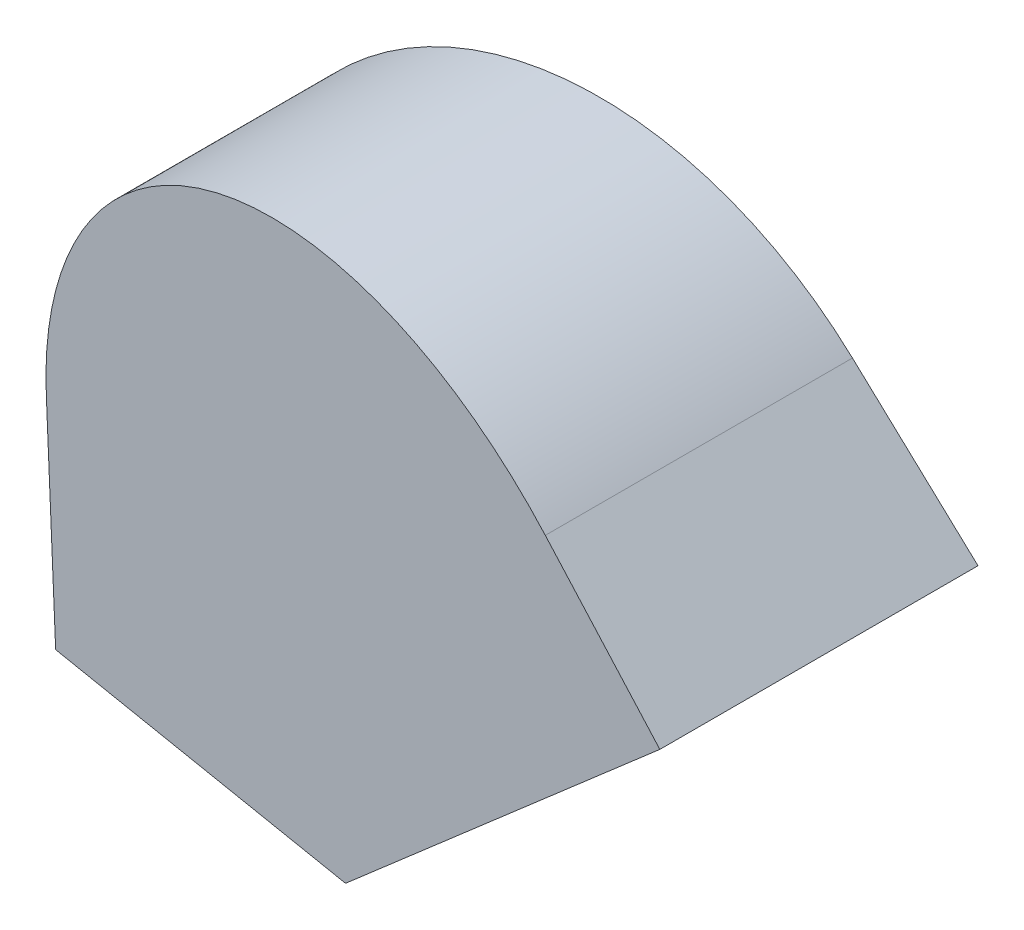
SolidWorks part; units mm, degrees
ref_plane "Front Plane" through (0, 0, 0) normal (0, 0, 1) x (1, 0, 0)
ref_plane "Top Plane" through (0, 0, 0) normal (0, 1, 0) x (1, 0, 0)
ref_plane "Right Plane" through (0, 0, 0) normal (1, 0, 0) x (0, 0, -1)
sketch "Sketch1" plane through (0, 0, 0) normal (0, 0, 1) x (1, 0, 0)
  line L0 (-36.5, 0) -> (0, 0)
  line L1 (0, 0) -> (43.474, 39.1441)
  line L2 (43.474, 39.1441) -> (30.2772, 51.4504)
  line L3 (-36.5, 0) -> (-35.1898, 25)
  line L4 (-36.5, 0) -> (-36.5, 25) construction
  line L5 (43.474, 39.1441) -> (22.2035, 62.7674) construction
  arc A0 (-35.1898, 25) -> (30.2772, 51.4504) centre (3.7107, 22.9613) cw
  dimension "D1" = 36.5
  dimension "D2" = 58.5
  dimension "D3" = 42
  dimension "D4" = 3
  dimension "D5" = 5
  dimension "D6" = 25
sketch "Sketch2" plane through (0, 0, 0) normal (0, 1, 0) x (1, 0, 0)
  line L1 (-36.5, 0) -> (0, 0)
  line L2 (0, 0) -> (0, -23)
  line L3 (0, -23) -> (-19.7629, -19.732)
  arc A0 (-19.7629, -19.732) -> (-36.5, 0) centre (-16.5, 0) cw
  dimension "D1" = 20
  dimension "D2" = 23
ref_plane "42 deg" through (0, 0, 0) normal (-0.6691, 0.7431, 0) x (-0.7431, -0.6691, 0)
sketch "Sketch3" plane through (0, 0, 0) normal (-0.6691, 0.7431, 0) x (-0.7431, -0.6691, 0)
  line L1 (0, 0) -> (0, 23)
  line L3 (0, 0) -> (-58.5, 0)
  line L4 (0, 23) -> (-25.5815, 27.5646)
  arc A0 (-25.5815, 27.5646) -> (-58.5, 0) centre (-30.5, 0) ccw
  dimension "D1" = 28
ref_plane "Up To" through (-3.6773, -1.8462, 22.2387) normal (-0.1626, -0.0816, 0.9833) x (0.9867, -0.0135, 0.162)
extrude "Boss-Extrude1" add sketch "Sketch1" along normal up to surface (16.9644 mm away)
